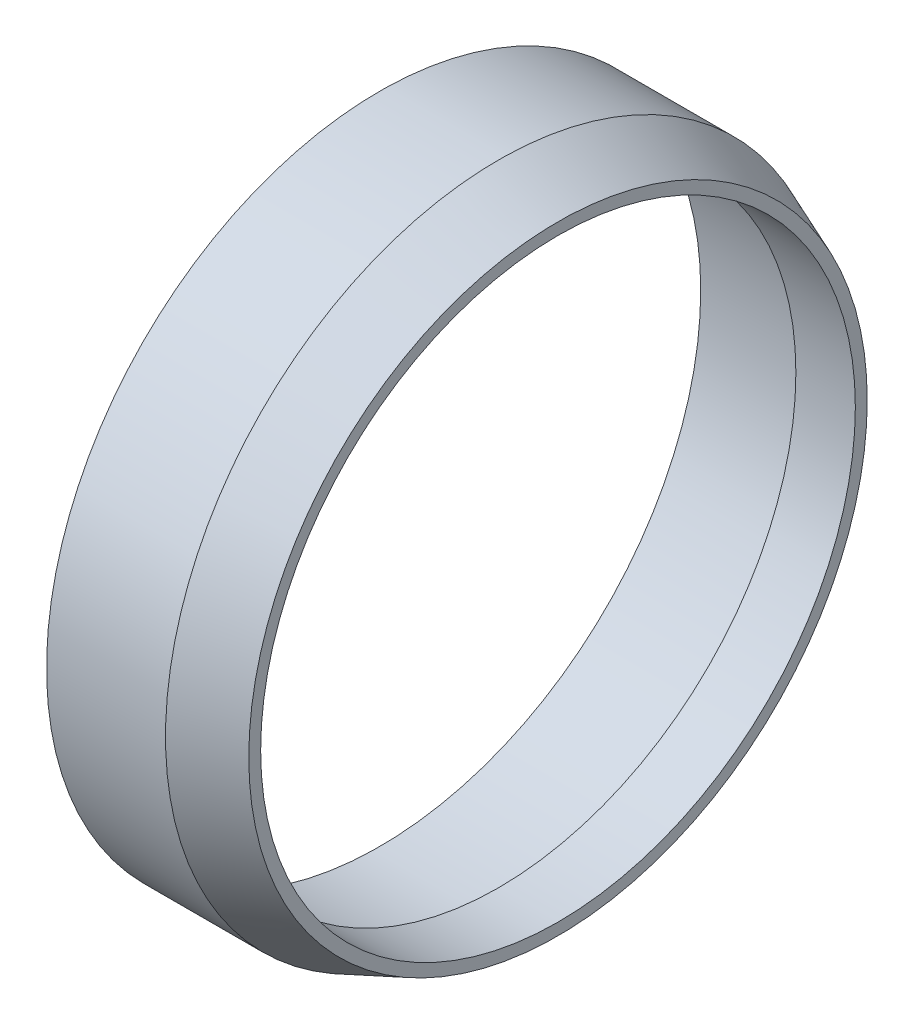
SolidWorks part; units mm, degrees
ref_plane "Plan1" through (0, 0, 0) normal (0, 0, 1) x (1, 0, 0)
ref_plane "Plan2" through (0, 0, 0) normal (0, 1, 0) x (1, 0, 0)
ref_plane "Plan3" through (0, 0, 0) normal (1, 0, 0) x (0, 0, -1)
sketch "Esquisse2" plane through (0, 0, 0) normal (0, 1, 0) x (1, 0, 0)
  line L0 (37.9005, 0) -> (-40, 0) construction
  line L1 (-92, 0) -> (-87, 0) construction
  line L2 (0, 0) -> (-100, 0) construction
  line L3 (0, -25) -> (0, -27)
  line L4 (0, -27) -> (0, 27) construction
  line L5 (0, -27) -> (-10, -27)
  line L6 (-84.5, -27) -> (0, -27) construction
  line L7 (-10, -27) -> (-10, -28)
  line L8 (-10, -28) -> (0, -28)
  line L9 (0, -28) -> (5, -26)
  line L10 (5, -26) -> (5, -25)
  line L11 (5, -25) -> (0, -25)
  line L14 (-84.5, -25) -> (0, -25) construction
  dimension "D1" = 5
  dimension "D2" = 1
  dimension "D3" = 10
revolve "Base-Révolution" add sketch "Esquisse2" angle 360 about L0
